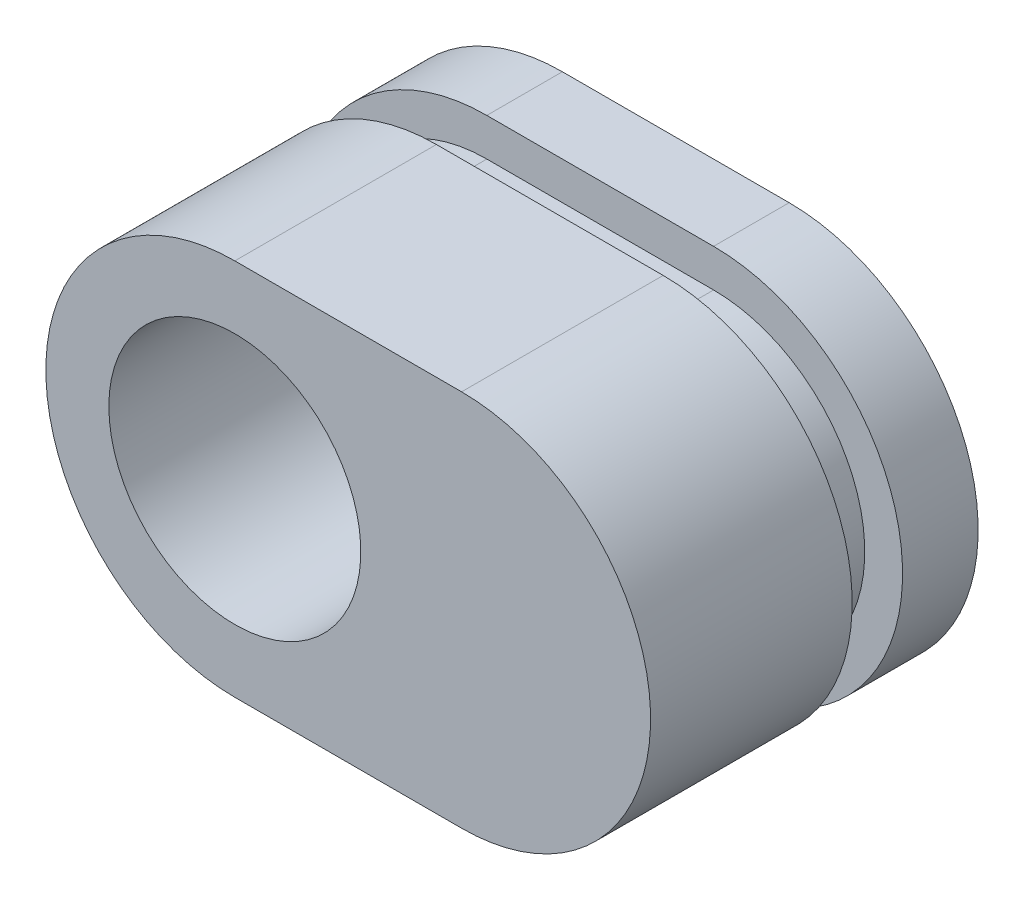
SolidWorks part; units mm, degrees
ref_plane "Front Plane" through (0, 0, 0) normal (0, 0, 1) x (1, 0, 0)
ref_plane "Top Plane" through (0, 0, 0) normal (0, 1, 0) x (1, 0, 0)
ref_plane "Right Plane" through (0, 0, 0) normal (1, 0, 0) x (0, 0, -1)
sketch "Croquis1" plane through (0, 0, 0) normal (0, 0, 1) x (1, 0, 0)
  line L0 (4.5, 0) -> (-4.5, 0) construction
  line L1 (4.5, -6) -> (-4.5, -6)
  line L2 (4.5, 6) -> (-4.5, 6)
  arc A1 (4.5, -6) -> (4.5, 6) centre (4.5, 0) ccw
  arc A2 (-4.5, 6) -> (-4.5, -6) centre (-4.5, 0) ccw
  point P3 (0, 0)
  point P9 (-10.5, 0)
  point P10 (10.5, 0)
  dimension "D1" = 6
  dimension "D2" = 21
extrude "Saliente-Extruir1" add sketch "Croquis1" along normal blind 2
sketch "Croquis2" plane through (0, 0, 2) normal (0, 0, 1) x (1, 0, 0)
  line L0 (-4.5, 0) -> (4.5, 0) construction
  line L5 (-4.5, 7.5) -> (4.5, 7.5)
  line L6 (-4.5, -7.5) -> (4.5, -7.5)
  arc A5 (-4.5, 7.5) -> (-4.5, -7.5) centre (-4.5, 0) ccw
  arc A6 (4.5, -7.5) -> (4.5, 7.5) centre (4.5, 0) ccw
  point P2 (0, 0)
  dimension "D1" = 7.5
extrude "Saliente-Extruir2" add sketch "Croquis2" along normal blind 8
sketch "Croquis3" plane through (0, 0, 0) normal (0, 0, -1) x (-1, 0, 0)
  line L0 (-4.5, 0) -> (4.5, 0) construction
  line L1 (-4.5, 7.5) -> (4.5, 7.5)
  line L2 (-4.5, -7.5) -> (4.5, -7.5)
  arc A0 (-4.5, 7.5) -> (-4.5, -7.5) centre (-4.5, 0) ccw
  arc A1 (4.5, -7.5) -> (4.5, 7.5) centre (4.5, 0) ccw
  point P4 (0, 0)
  dimension "D1" = 7.5
extrude "Saliente-Extruir3" add sketch "Croquis3" along normal blind 3
sketch "Croquis4" plane through (0, 0, -3) normal (0, 0, -1) x (-1, 0, 0)
  circle A0 centre (4.5, 0) radius 5
  dimension "D1" = 10
extrude "Cortar-Extruir1" cut sketch "Croquis4" against normal blind 13
